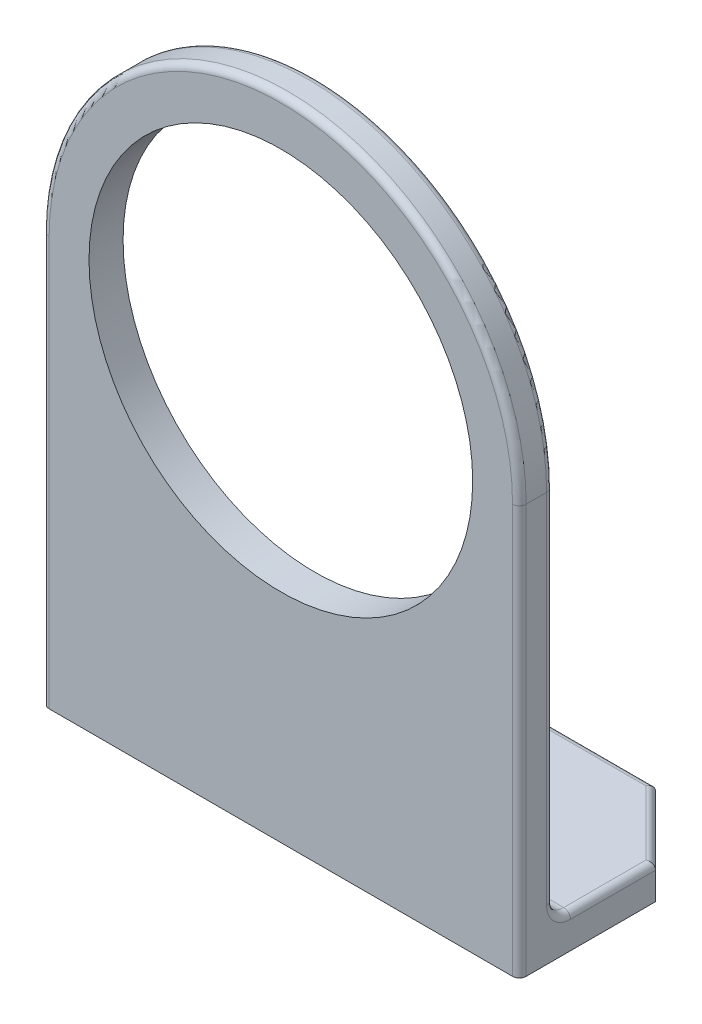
SolidWorks part; units mm, degrees
ref_plane "Front Plane" through (0, 0, 0) normal (0, 0, 1) x (1, 0, 0)
ref_plane "Top Plane" through (0, 0, 0) normal (0, 1, 0) x (1, 0, 0)
ref_plane "Right Plane" through (0, 0, 0) normal (1, 0, 0) x (0, 0, -1)
sketch "Sketch1" plane through (0, 0, 0) normal (0, 0, 1) x (1, 0, 0)
  line L1 (-44.45, 0) -> (-44.45, -76.2)
  line L3 (44.45, 0) -> (44.45, -76.2)
  line L4 (-44.45, -76.2) -> (44.45, -76.2)
  line L5 (44.45, -76.2) -> (43.9082, -75.822)
  circle A0 centre (0, 0) radius 35.75
  arc A1 (44.45, 0) -> (-44.45, 0) centre (0, 0) ccw
extrude "Extrude2" add sketch "Sketch1" along normal blind 6.35
sketch "Sketch3" plane through (0, 0, 0) normal (0, 0, -1) x (-1, 0, 0)
  line L1 (-44.45, -69.85) -> (-44.45, -76.2)
  line L2 (-44.45, -69.85) -> (44.45, -69.85)
  line L3 (-44.45, -69.85) -> (44.45, -69.85)
  line L4 (44.45, -69.85) -> (44.45, -76.2)
  line L8 (-44.45, -76.2) -> (44.45, -76.2)
  line L9 (44.45, -76.2) -> (44.45, 0)
  line L10 (-44.45, 0) -> (-44.45, -76.2)
  line L11 (-44.45, -76.2) -> (44.45, -76.2)
  arc A1 (44.45, 0) -> (-44.45, 0) centre (0, 0) ccw
  dimension "D1" = 6.35
  dimension "D2" = 0
extrude "Extrude3" add sketch "Sketch3" along normal blind 31.75
chamfer "Chamfer1" distance 12.7 angle 45 1 edges at (44.45, -73.025, -31.75)
chamfer "Chamfer2" distance 12.7 angle 45 1 edges at (-44.45, -73.025, -31.75)
fillet "Fillet2" radius 3.175 1 edges
sketch "Sketch4" plane through (0, -69.85, 0) normal (0, 1, 0) x (1, 0, 0)
  circle A0 centre (0, 23.8152) radius 3.2512
  circle A1 centre (22.225, 9.5277) radius 3.2512
  circle A2 centre (-22.225, 9.5277) radius 3.2512
extrude "Cut-Extrude1" cut sketch "Sketch4" against normal through all
fillet "Fillet3" radius 1.27 13 edges at (44.45, -38.1, 6.35) (0, 44.45, 6.35) (-44.45, -38.1, 6.35) (-44.45, -68.9201, -0.9299) (0, 44.45, 0) (44.45, -68.9201, -0.9299) (38.1, -69.85, -25.4) (0, -69.85, -31.75) (-38.1, -69.85, -25.4)
